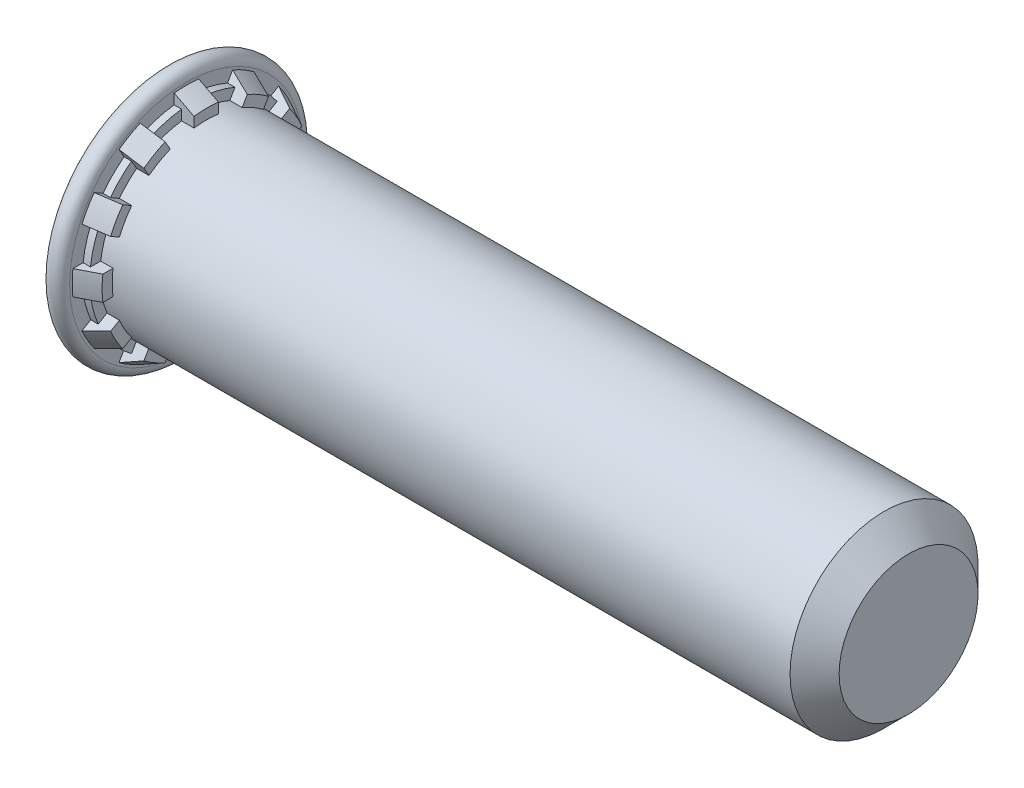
SolidWorks part; units mm, degrees
ref_plane "Plane1" through (0, 0, 0) normal (0, 0, 1) x (1, 0, 0)
ref_plane "Plane2" through (0, 0, 0) normal (0, 1, 0) x (1, 0, 0)
ref_plane "Plane3" through (0, 0, 0) normal (1, 0, 0) x (0, 0, -1)
sketch "BodySke" plane through (0, 0, 0) normal (0, 0, 1) x (1, 0, 0)
  line L0 (0, 0) -> (0, 2.9947)
  line L1 (0.508, 2.9997) -> (0.508, 2.9337)
  line L2 (0.508, 2.9337) -> (1.016, 2.6733)
  line L3 (1.016, 2.413) -> (18.4201, 2.413)
  line L4 (19.05, 1.7831) -> (19.05, 0)
  line L5 (19.05, 0) -> (0, 0)
  line L6 (0, 0) -> (50.554, 0) construction
  line L7 (1.016, 2.6733) -> (1.016, 2.413)
  line L8 (19.05, 1.7831) -> (18.4201, 2.413)
  line L9 (-9.525, 3.2512) -> (9.525, 3.2512) construction
  line L11 (2.0752, 19.05) -> (2.0752, -3.175) construction
  line L13 (9.525, -3.2512) -> (-9.525, -3.2512) construction
  line L14 (0.0051, 2.9997) -> (0.0051, 2.9947)
  line L15 (0, 2.9947) -> (0.0051, 2.9947)
  arc A0 (0.0051, 2.9997) -> (0.508, 2.9997) centre (0.2565, 2.9997) cw
  dimension "D2" = 0.0051
  dimension "D1" = 0.0051
  dimension "Diameter" = 4.826
  dimension "Length" = 19.05
  dimension "Body_ch_ang" = 45
  dimension "Minor_dia" = 3.5662
  dimension "Advance" = 1.0592
  dimension "H_dia" = 6.5024
  dimension "Shoulder_lower_dia" = 5.8674
  dimension "Shoulder_upper_dia" = 5.3467
  dimension "Shoulder_ht" = 1.016
  dimension "T_dim" = 0.508
revolve "BaseBody" add sketch "BodySke" angle 360 about L6
sketch "ThdSchSke" plane through (0, 0, 0) normal (0, 0, 1) x (1, 0, 0)
  line L0 (2.54, -1.7831) -> (2.0989, -2.413)
  line L1 (2.54, -1.7831) -> (2.9811, -2.413)
  line L2 (2.9811, -2.413) -> (2.9811, -3.0162)
  line L3 (-3.175, 0) -> (5.1513, 0) construction
  line L5 (2.9811, -3.0162) -> (2.0989, -3.0162)
  line L6 (2.0989, -3.0162) -> (2.0989, -2.413)
  line L7 (0, 2.9947) -> (0, -2.9947) construction
  dimension "Thread_minor" = 3.5662
  dimension "Diameter" = 4.826
  dimension "Start" = 2.54
  dimension "SideAngle" = 55
  dimension "VeeAngle" = 70
  dimension "Overcut" = 6.0325
revolve "ThreadSchematic" [suppressed] cut sketch "ThdSchSke" angle 360 about L3
pattern_linear "ThdSchPat" [suppressed]
sketch "RibCut1Ske" plane through (1.016, 0, 0) normal (1, 0, 0) x (0, 0, -1)
  line L0 (0.315, 2.3924) -> (0.315, 3.2359)
  line L1 (0.9234, 2.2293) -> (1.3452, 2.9599)
  line L2 (0, 0) -> (0, 4.9784) construction
  line L3 (0, 0) -> (0.315, 2.3924) construction
  line L4 (0, 0) -> (0.9234, 2.2293) construction
  arc A1 (0.9234, 2.2293) -> (0.315, 2.3924) centre (0, 0) ccw
  arc A2 (1.3452, 2.9599) -> (0.315, 3.2359) centre (0, 0) ccw
  dimension "Inner_dia" = 4.826
  dimension "Outer_dia" = 6.5024
  dimension "Rib_root_half_angle" = 7.5
  dimension "Rib_root_gap_angle" = 15
  dimension "Angle" = 30
extrude "RibCut1" cut sketch "RibCut1Ske" against normal blind 0.3175
sketch "RibCut2Ske" plane through (1.016, 0, 0) normal (1, 0, 0) x (0, 0, -1)
  line L0 (0.315, 2.6547) -> (0.315, 3.2359)
  line L1 (1.0546, 2.4565) -> (1.3452, 2.9599)
  line L2 (0.315, 2.3924) -> (0.315, 4.2041) construction
  line L3 (0, 0) -> (0, 5.0239) construction
  line L4 (0, 0) -> (0.315, 2.3924) construction
  line L5 (0, 0) -> (0.9234, 2.2293) construction
  line L6 (0.9234, 2.2293) -> (1.8328, 3.8045) construction
  arc A1 (1.0546, 2.4565) -> (0.315, 2.6547) centre (0, 0) ccw
  arc A2 (1.3452, 2.9599) -> (0.315, 3.2359) centre (0, 0) ccw
  circle A4 centre (0, 0) radius 2.413 construction
  dimension "Inner_dia" = 5.3467
  dimension "Outer_dia" = 6.5024
  dimension "Rib_root_dia" = 4.826
  dimension "Rib_root_half_angle" = 7.5
  dimension "Rib_root_gap_angle" = 15
  dimension "Angle" = 30
extrude "RibCut2" cut sketch "RibCut2Ske" against normal blind 0.508
pattern_circular "RibCutsPat" count 12 every 30 about axis through (0, 0, 0) along (1, 0, 0) of "RibCut2", "RibCut1"
equation "' \"Length@BodySke\" = 0.75"
equation "' \"H_dia@BodySke\" = 0.337"
equation "' \"Start@ThdSchSke\" = 0.135"
equation "' \"Diameter@BodySke\" = 0.25"
equation "' \"Minor_dia@BodySke\" =0.1905"
equation "' \"Advance@BodySke\" = 0.05"
equation "\"T_dim@BodySke\" = \"Start@ThdSchSke\" * 0.2"
equation "\"Shoulder_ht@BodySke\" = \"Start@ThdSchSke\" * 0.4"
equation "\"Shoulder_lower_dia@BodySke\" = \"H_dia@BodySke\" - \"Start@ThdSchSke\" * 0.2 - .005"
equation "\"Shoulder_upper_dia@BodySke\" = ( \"Shoulder_lower_dia@BodySke\" + \"Diameter@BodySke\" ) /2"
equation "\"Num_ribs@RibCutsPat\" = 12"
equation "\"Angle@RibCutsPat\" = 360 / \"Num_ribs@RibCutsPat\""
equation "\"Angle@RibCut1Ske\" =\"Angle@RibCutsPat\""
equation "\"Rib_root_half_angle@RibCut1Ske\" = \"Angle@RibCut1Ske\" / 4"
equation "\"Rib_root_gap_angle@RibCut1Ske\" = \"Angle@RibCut1Ske\" - (2 * \"Rib_root_half_angle@RibCut1Ske\" )"
equation "\"Inner_dia@RibCut1Ske\" = \"Diameter@BodySke\""
equation "\"Outer_dia@RibCut1Ske\" = \"H_dia@BodySke\""
equation "\"Depth@RibCut1\" =  \"Start@ThdSchSke\" * 0.125"
equation "\"Angle@RibCut2Ske\" =\"Angle@RibCutsPat\""
equation "\"Rib_root_half_angle@RibCut2Ske\" = \"Angle@RibCut1Ske\" / 4"
equation "\"Rib_root_gap_angle@RibCut2Ske\" = \"Angle@RibCut1Ske\" - (2 * \"Rib_root_half_angle@RibCut1Ske\" )"
equation "\"Rib_root_dia@RibCut2Ske\" = \"Diameter@BodySke\""
equation "\"Inner_dia@RibCut2Ske\" = \"Shoulder_upper_dia@BodySke\""
equation "\"Outer_dia@RibCut2Ske\" = \"H_dia@BodySke\""
equation "\"Depth@RibCut2\" =  \"Start@ThdSchSke\" * 0.2"
equation "\"Thread_length@ThreadCosmetic\" = \"Length@BodySke\" - \"Start@ThdSchSke\""
equation "\"Thread_minor@ThreadCosmetic\" = \"Minor_dia@BodySke\""
equation "\"Thread_minor@ThdSchSke\" = \"Minor_dia@BodySke\""
equation "\"Diameter@ThdSchSke\" = \"Diameter@BodySke\""
equation "\"Overcut@ThdSchSke\" = \"Diameter@BodySke\" * 1.25"
equation "\"Num_threads@ThdSchPat\" = int( \"Thread_length@ThreadCosmetic\" / \"Advance@BodySke\" + 0.999 )  + 1"
equation "\"Advance@ThdSchPat\" = \"Thread_length@ThreadCosmetic\" /  (\"Num_threads@ThdSchPat\" - 1) 'relax it"
equation "\"Num_threads@ThdSchPat\" = \"Num_threads@ThdSchPat\" - sgn( \"Num_threads@ThdSchPat\" - 1) '---chamfered tips only---"
